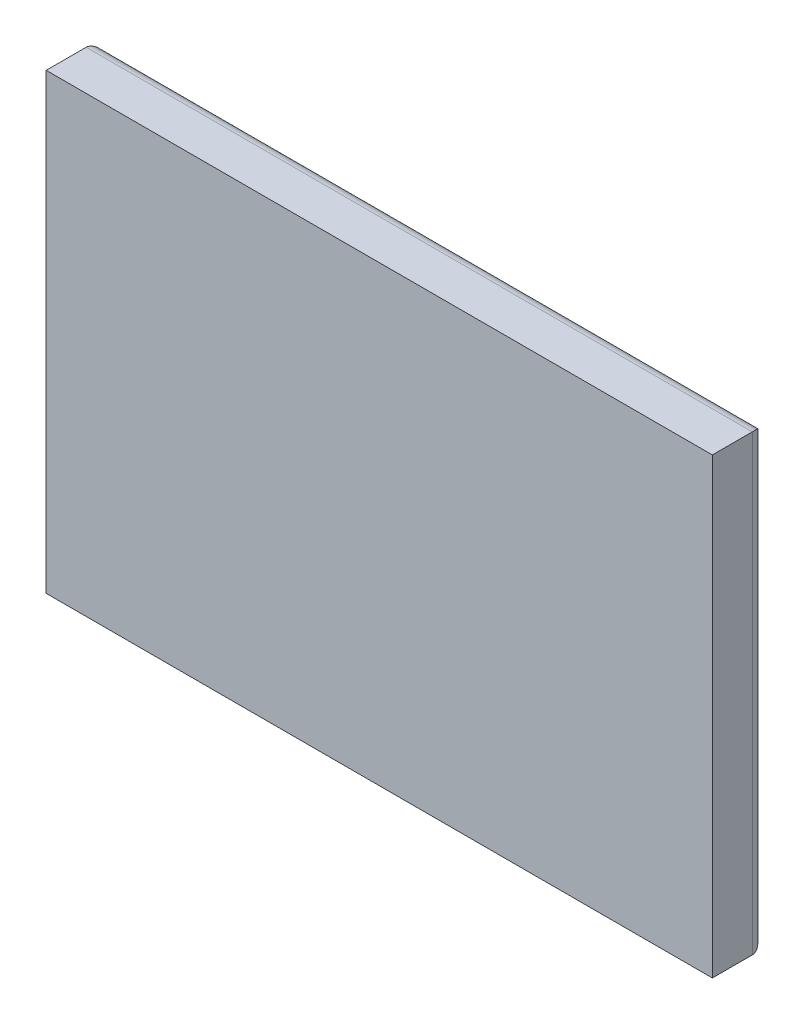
SolidWorks part; units mm, degrees
ref_plane "Front Plane" through (0, 0, 0) normal (0, 0, 1) x (1, 0, 0)
ref_plane "Top Plane" through (0, 0, 0) normal (0, 1, 0) x (1, 0, 0)
ref_plane "Right Plane" through (0, 0, 0) normal (1, 0, 0) x (0, 0, -1)
sketch "Sketch1" plane through (0, 0, 0) normal (0, 0, 1) x (1, 0, 0)
  line L1 (-15.875, -10.795) -> (15.875, -10.795)
  line L2 (-15.875, -10.795) -> (-15.875, 10.795)
  line L3 (-15.875, 10.795) -> (15.875, 10.795)
  line L4 (15.875, -10.795) -> (15.875, 10.795)
  line L5 (-15.875, -10.795) -> (15.875, 10.795) construction
  line L6 (-15.875, 10.795) -> (15.875, -10.795) construction
  point P0 (0, 0)
  dimension "D1" = 31.75
  dimension "D2" = 21.59
extrude "Boss-Extrude1" add sketch "Sketch1" along normal blind 2.54
fillet "Fillet1" radius 0.635 4 edges at (-15.875, 0, 0) (0, -10.795, 0) (0, 10.795, 0) (15.875, 0, 0)
sketch "Sketch2" plane through (0, 0, 2.54) normal (0, 0, 1) x (1, 0, 0)
  line L0 (-15.875, 10.795) -> (-14.977, 9.897) construction
  line L1 (-14.977, 9.897) -> (-14.977, 6.598) construction
  line L2 (-14.977, 6.598) -> (-14.977, 3.299) construction
  line L3 (-14.977, 3.299) -> (-14.977, 0) construction
  line L4 (-14.977, 0) -> (-14.977, -3.299) construction
  line L5 (-14.977, -3.299) -> (-14.977, -6.598) construction
  line L6 (-14.977, -6.598) -> (-14.977, -9.897) construction
  line L7 (-14.977, -9.897) -> (-15.875, -10.795) construction
  line L8 (15.875, 10.795) -> (-15.875, 10.795) construction
  line L9 (-15.875, -10.795) -> (15.875, -10.795) construction
  line L10 (-14.977, -9.897) -> (14.977, -9.897) construction
  line L11 (14.977, -9.897) -> (15.875, -10.795) construction
  line L12 (14.977, -9.897) -> (14.977, -6.598) construction
  line L13 (14.977, -6.598) -> (14.977, -3.299) construction
  line L14 (14.977, -3.299) -> (14.977, 0) construction
  line L15 (14.977, 0) -> (14.977, 3.299) construction
  line L16 (14.977, 3.299) -> (14.977, 6.598) construction
  line L17 (14.977, 6.598) -> (14.977, 9.897) construction
  line L18 (14.977, 9.897) -> (15.875, 10.795) construction
  line L19 (-14.977, 9.897) -> (14.977, 9.897) construction
  line L20 (-14.977, 6.598) -> (14.977, 6.598) construction
  line L21 (-14.977, 3.299) -> (14.977, 3.299) construction
  line L22 (-14.977, 0) -> (14.977, 0) construction
  line L23 (-14.977, -3.299) -> (14.977, -3.299) construction
  line L24 (-14.977, -6.598) -> (14.977, -6.598) construction
  dimension "D1" = 45
  dimension "D2" = 45
  dimension "D3" = 1.27
